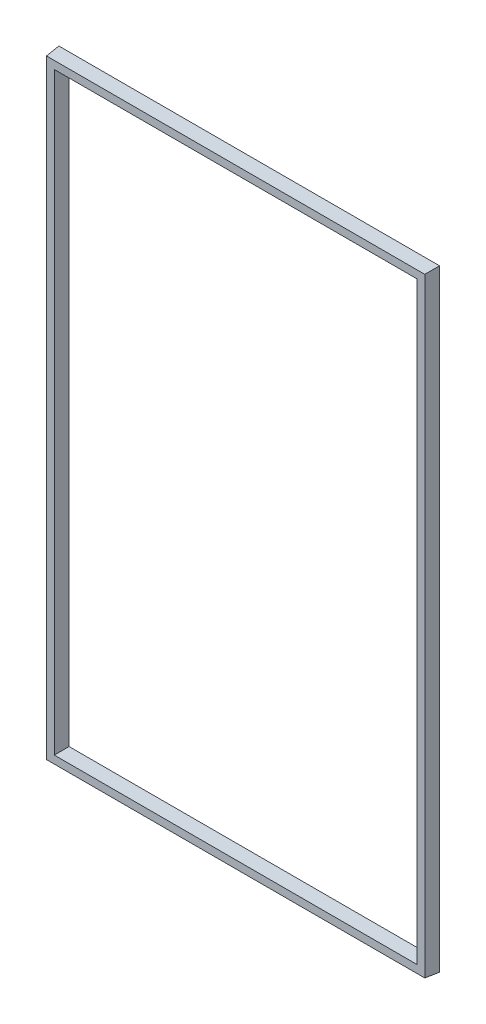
SolidWorks part; units mm, degrees
ref_plane "Front Plane" through (0, 0, 0) normal (0, 0, 1) x (1, 0, 0)
ref_plane "Top Plane" through (0, 0, 0) normal (0, 1, 0) x (1, 0, 0)
ref_plane "Right Plane" through (0, 0, 0) normal (1, 0, 0) x (0, 0, -1)
sketch "Sketch1" plane through (0, 0, 0) normal (0, 0, 1) x (1, 0, 0)
  line L8 (-61.5, -96) -> (-8.5, -96)
  line L9 (-61.5, -9) -> (-61.5, -96)
  line L10 (-8.5, -9) -> (-61.5, -9)
  line L11 (-8.5, -96) -> (-8.5, -9)
  line L24 (-7, -97.5) -> (-7, -93)
  line L25 (-7, -93) -> (-7, -12)
  line L26 (-7, -12) -> (-7, -7.5)
  line L27 (-7, -7.5) -> (-63, -7.5)
  line L28 (-63, -7.5) -> (-63, -12)
  line L29 (-63, -12) -> (-63, -93)
  line L30 (-63, -93) -> (-63, -97.5)
  line L31 (-63, -97.5) -> (-7, -97.5)
extrude "Boss-Extrude1" add sketch "Sketch1" along normal blind 2 draft 5
